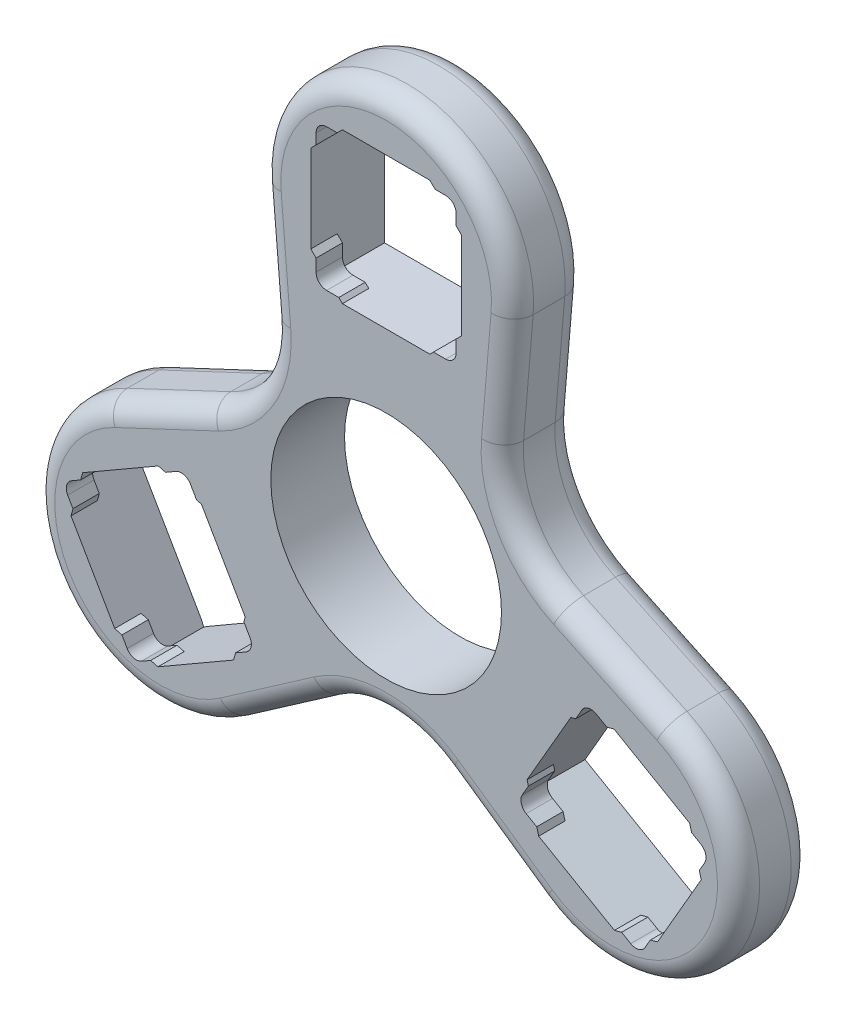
SolidWorks part; units mm, degrees
ref_plane "Plan de face" through (0, 0, 0) normal (0, 0, 1) x (1, 0, 0)
ref_plane "Plan de dessus" through (0, 0, 0) normal (0, 1, 0) x (1, 0, 0)
ref_plane "Plan de droite" through (0, 0, 0) normal (1, 0, 0) x (0, 0, -1)
sketch "Esquisse1" plane through (0, 0, 0) normal (0, 0, 1) x (1, 0, 0)
  line L0 (0, 0) -> (0, 41.5934) construction
  line L1 (24.2677, -22.2671) -> (11.8836, -15.1171)
  line L2 (-7.15, 32.15) -> (7.15, 32.15)
  line L3 (-7.15, 32.15) -> (-7.15, 17.85)
  line L4 (-7.15, 17.85) -> (7.15, 17.85)
  line L5 (7.15, 32.15) -> (7.15, 17.85)
  line L6 (-7.15, 32.15) -> (7.15, 17.85) construction
  line L7 (-7.15, 17.85) -> (7.15, 32.15) construction
  line L8 (19.0336, -2.7329) -> (11.8836, -15.1171)
  line L9 (31.4177, -9.8829) -> (19.0336, -2.7329)
  line L10 (31.4177, -9.8829) -> (24.2677, -22.2671)
  line L11 (-31.4177, -9.8829) -> (-19.0336, -2.7329)
  line L12 (-11.8836, -15.1171) -> (-19.0336, -2.7329)
  line L13 (-24.2677, -22.2671) -> (-11.8836, -15.1171)
  line L14 (-24.2677, -22.2671) -> (-31.4177, -9.8829)
  line L15 (-12, 25) -> (12, 25) construction
  line L22 (-11.9578, 23.9947) -> (-10.4674, 6.2672)
  line L23 (11.9578, 23.9947) -> (10.4674, 6.2672)
  line L24 (26.5651, -1.3058) -> (10.4674, 6.2672)
  line L25 (14.6073, -22.0174) -> (0, -11.8629)
  line L26 (-14.6073, -22.0174) -> (0, -11.8629)
  line L27 (-26.5651, -1.3058) -> (-10.4674, 6.2672)
  circle A0 centre (0, 0) radius 10.95
  circle A1 centre (0, 0) radius 25 construction
  arc A6 (11.9578, 23.9947) -> (-11.9578, 23.9947) centre (0, 25) ccw
  arc A7 (14.6073, -22.0174) -> (26.5651, -1.3058) centre (21.4568, -12.1643) ccw
  arc A8 (-26.5651, -1.3058) -> (-14.6073, -22.0174) centre (-21.4568, -12.1643) ccw
  point P4 (0, 25)
  point P20 (0, 0)
  point P36 (0, 0)
  point P42 (0, 0.2238)
  dimension "D1" = 21.9
  dimension "D2" = 50
  dimension "D6" = 24
  dimension "D3" = 14.3
  dimension "D4" = 14.3
  dimension "D7" = 3
  dimension "D5" = 3
extrude "Boss.-Extru.1" add sketch "Esquisse1" along normal mid plane 7
fillet "Congé1" radius 10 3 edges at (0, -11.8629, 0) (-10.4674, 6.2672, 0) (10.4674, 6.2672, 0)
sketch "Esquisse4" plane through (0, 0, 3.5) normal (0, 0, 1) x (1, 0, 0)
  line L0 (0, 0) -> (0, 32.15) construction
  line L3 (7.15, 32.15) -> (-7.15, 32.15) construction
  line L6 (-7.15, 25) -> (7.15, 25) construction
  line L8 (-7.15, 32.15) -> (-7.15, 17.85) construction
  line L9 (7.15, 17.85) -> (7.15, 32.15) construction
  circle A7 centre (0, 25) radius 10.5
  circle A8 centre (21.6506, -12.5) radius 10.5
  circle A9 centre (-21.6506, -12.5) radius 10.5
  point P18 (0, 0)
  point P19 (0, 0)
  point P20 (0, 0)
  point P22 (0, 0)
  point P23 (0, 0)
  dimension "D1" = 21
  dimension "D2" = 3
  dimension "D3" = 3
extrude "Boss.-Extru.2" add sketch "Esquisse4" against normal blind 2.5
fillet "Congé2" radius 2 24 edges at (11.5038, 18.5945, 3.5) (11.5038, 18.5945, -3.5) (12.3544, 7.3566, 3.5) (12.3544, 7.3566, -3.5) (21.6614, 1.0011, -3.5) (21.6614, 1.0011, 3.5) (31.8491, -18.1643, -3.5) (31.8491, -18.1643, 3.5) (10.1576, -18.9241, 3.5) (10.1576, -18.9241, -3.5) (0, -14.0418, 3.5) (0, -14.0418, -3.5) (-10.1576, -18.9241, -3.5) (-10.1576, -18.9241, 3.5) (-31.8491, -18.1643, -3.5) (-31.8491, -18.1643, 3.5) (-21.6614, 1.0011, 3.5) (-21.6614, 1.0011, -3.5) (-12.3544, 7.3566, 3.5) (-12.3544, 7.3566, -3.5) (-11.5038, 18.5945, -3.5) (-11.5038, 18.5945, 3.5) (0, 37, -3.5) (0, 37, 3.5)
sketch "Esquisse5" plane through (0, 0, 3.5) normal (0, 0, 1) x (1, 0, 0)
  line L0 (0, 0) -> (0, 35) construction
  line L1 (0, 0) -> (30.117, -17.1643) construction
  line L2 (0, 0) -> (-30.117, -17.1643) construction
  arc A0 (9.9648, 24.1622) -> (-9.9648, 24.1622) centre (0, 25) ccw construction
  arc A1 (15.7488, -20.3752) -> (25.7137, -3.1156) centre (21.4568, -12.1643) ccw construction
  arc A2 (-25.7137, -3.1156) -> (-15.7488, -20.3752) centre (-21.4568, -12.1643) ccw construction
sketch "Esquisse6" plane through (0, 0, 1) normal (0, 0, -1) x (-1, 0, 0)
  line L0 (0, 32.15) -> (0, 17.85) construction
  line L1 (-7.15, 32.15) -> (7.15, 32.15) construction
  line L2 (7.15, 17.85) -> (-7.15, 17.85) construction
  line L3 (-7.15, 24.9206) -> (7.15, 25) construction
  line L4 (-7.15, 17.85) -> (-7.15, 31.9912) construction
  line L5 (7.15, 32.15) -> (7.15, 17.85) construction
  line L6 (-7.15, 29.15) -> (-4.15, 32.15)
  line L7 (-4.15, 32.15) -> (4.15, 32.15)
  line L8 (-7.15, 29.15) -> (-7.15, 20.85)
  line L9 (-4.15, 17.85) -> (4.15, 17.85)
  line L10 (7.15, 29.15) -> (7.15, 20.85)
  line L11 (4.15, 32.15) -> (7.15, 29.15)
  line L12 (4.15, 17.85) -> (7.15, 20.85)
  line L13 (-7.15, 20.85) -> (-4.15, 17.85)
  line L14 (17.5336, -5.331) -> (13.3836, -12.519)
  line L15 (13.3836, -12.519) -> (14.4816, -16.6171)
  line L16 (21.6696, -20.7671) -> (14.4816, -16.6171)
  line L17 (25.7677, -19.669) -> (21.6696, -20.7671)
  line L18 (29.9177, -12.481) -> (25.7677, -19.669)
  line L19 (28.8196, -8.3829) -> (29.9177, -12.481)
  line L20 (28.8196, -8.3829) -> (21.6316, -4.2329)
  line L21 (21.6316, -4.2329) -> (17.5336, -5.331)
  line L22 (-13.3836, -12.519) -> (-17.5336, -5.331)
  line L23 (-17.5336, -5.331) -> (-21.6316, -4.2329)
  line L24 (-28.8196, -8.3829) -> (-21.6316, -4.2329)
  line L25 (-29.9177, -12.481) -> (-28.8196, -8.3829)
  line L26 (-25.7677, -19.669) -> (-29.9177, -12.481)
  line L27 (-21.6696, -20.7671) -> (-25.7677, -19.669)
  line L28 (-21.6696, -20.7671) -> (-14.4816, -16.6171)
  line L29 (-14.4816, -16.6171) -> (-13.3836, -12.519)
  point P12 (-7.15, 32.15)
  point P13 (7.15, 17.85)
  point P14 (-7.15, 17.85)
  point P15 (7.15, 32.15)
  point P20 (0, 0)
  point P45 (0, 0)
  dimension "D1" = 3
extrude "Enlèv. mat.-Extru.1" cut sketch "Esquisse6" against normal through all
sketch "Esquisse7" plane through (0, 0, 1) normal (0, 0, -1) x (-1, 0, 0)
  line L0 (-4.15, 32.15) -> (-7.15, 29.15) construction
  line L1 (-5.65, 31.65) -> (-4.15, 31.65)
  line L2 (-6.65, 30.65) -> (-6.65, 29.15)
  line L3 (-6.65, 29.15) -> (-4.15, 29.15)
  line L4 (-4.15, 29.15) -> (-4.15, 31.65)
  line L5 (7.15, 24.9206) -> (-7.15, 24.9206) construction
  line L6 (6.65, 30.65) -> (6.65, 29.15)
  line L7 (7.15, 31.9912) -> (7.15, 17.85) construction
  line L8 (-7.15, 17.85) -> (-7.15, 31.9912) construction
  line L9 (0, 17.85) -> (0, 32.1711) construction
  line L10 (7.15, 17.85) -> (-7.15, 17.85) construction
  line L11 (0, 0) -> (0, 35) construction
  line L12 (5.65, 31.65) -> (4.15, 31.65)
  line L13 (4.15, 29.15) -> (4.15, 31.65)
  line L14 (6.65, 29.15) -> (4.15, 29.15)
  line L15 (6.65, 19.1912) -> (6.65, 20.6912)
  line L16 (5.65, 18.1912) -> (4.15, 18.1912)
  line L17 (4.15, 20.6912) -> (4.15, 18.1912)
  line L18 (6.65, 20.6912) -> (4.15, 20.6912)
  line L19 (-6.65, 19.1912) -> (-6.65, 20.6912)
  line L20 (-5.65, 18.1912) -> (-4.15, 18.1912)
  line L21 (-4.15, 20.6912) -> (-4.15, 18.1912)
  line L22 (-6.65, 20.6912) -> (-4.15, 20.6912)
  line L23 (21.2441, -4.5866) -> (19.9941, -6.7516)
  line L24 (19.9941, -6.7516) -> (17.8291, -5.5016)
  line L25 (18.5791, -4.2026) -> (17.8291, -5.5016)
  line L26 (19.9451, -3.8366) -> (21.2441, -4.5866)
  line L27 (14.5941, -16.1047) -> (15.8441, -13.9396)
  line L28 (15.8441, -13.9396) -> (13.6791, -12.6896)
  line L29 (12.9291, -13.9887) -> (13.6791, -12.6896)
  line L30 (13.2951, -15.3547) -> (14.5941, -16.1047)
  line L31 (21.9196, -20.3341) -> (23.1696, -18.169)
  line L32 (23.1696, -18.169) -> (25.3347, -19.419)
  line L33 (24.5847, -20.718) -> (25.3347, -19.419)
  line L34 (23.2187, -21.0841) -> (21.9196, -20.3341)
  line L35 (28.5696, -8.8159) -> (27.3196, -10.981)
  line L36 (27.3196, -10.981) -> (29.4847, -12.231)
  line L37 (30.2347, -10.932) -> (29.4847, -12.231)
  line L38 (29.8687, -9.5659) -> (28.5696, -8.8159)
  line L39 (-14.5941, -16.1047) -> (-15.8441, -13.9396)
  line L40 (-15.8441, -13.9396) -> (-13.6791, -12.6896)
  line L41 (-12.9291, -13.9887) -> (-13.6791, -12.6896)
  line L42 (-13.2951, -15.3547) -> (-14.5941, -16.1047)
  line L43 (-21.2441, -4.5866) -> (-19.9941, -6.7516)
  line L44 (-19.9941, -6.7516) -> (-17.8291, -5.5016)
  line L45 (-18.5791, -4.2026) -> (-17.8291, -5.5016)
  line L46 (-19.9451, -3.8366) -> (-21.2441, -4.5866)
  line L47 (-28.5696, -8.8159) -> (-27.3196, -10.981)
  line L48 (-27.3196, -10.981) -> (-29.4847, -12.231)
  line L49 (-30.2347, -10.932) -> (-29.4847, -12.231)
  line L50 (-29.8687, -9.5659) -> (-28.5696, -8.8159)
  line L51 (-21.9196, -20.3341) -> (-23.1696, -18.169)
  line L52 (-23.1696, -18.169) -> (-25.3347, -19.419)
  line L53 (-24.5847, -20.718) -> (-25.3347, -19.419)
  line L54 (-23.2187, -21.0841) -> (-21.9196, -20.3341)
  arc A0 (-5.65, 31.65) -> (-6.65, 30.65) centre (-5.65, 30.65) ccw
  arc A1 (5.65, 31.65) -> (6.65, 30.65) centre (5.65, 30.65) cw
  arc A2 (5.65, 18.1912) -> (6.65, 19.1912) centre (5.65, 19.1912) ccw
  arc A3 (-5.65, 18.1912) -> (-6.65, 19.1912) centre (-5.65, 19.1912) cw
  arc A4 (18.5791, -4.2026) -> (19.9451, -3.8366) centre (19.4451, -4.7026) cw
  arc A5 (12.9291, -13.9887) -> (13.2951, -15.3547) centre (13.7951, -14.4887) ccw
  arc A6 (24.5847, -20.718) -> (23.2187, -21.0841) centre (23.7187, -20.218) cw
  arc A7 (30.2347, -10.932) -> (29.8687, -9.5659) centre (29.3687, -10.432) ccw
  arc A8 (-12.9291, -13.9887) -> (-13.2951, -15.3547) centre (-13.7951, -14.4887) cw
  arc A9 (-18.5791, -4.2026) -> (-19.9451, -3.8366) centre (-19.4451, -4.7026) ccw
  arc A10 (-30.2347, -10.932) -> (-29.8687, -9.5659) centre (-29.3687, -10.432) cw
  arc A11 (-24.5847, -20.718) -> (-23.2187, -21.0841) centre (-23.7187, -20.218) ccw
  point P89 (0, 0)
  dimension "D1" = 2
  dimension "D2" = 2.5
  dimension "D3" = 2.5
  dimension "D4" = 3
extrude "Enlèv. mat.-Extru.2" cut sketch "Esquisse7" against normal through all
